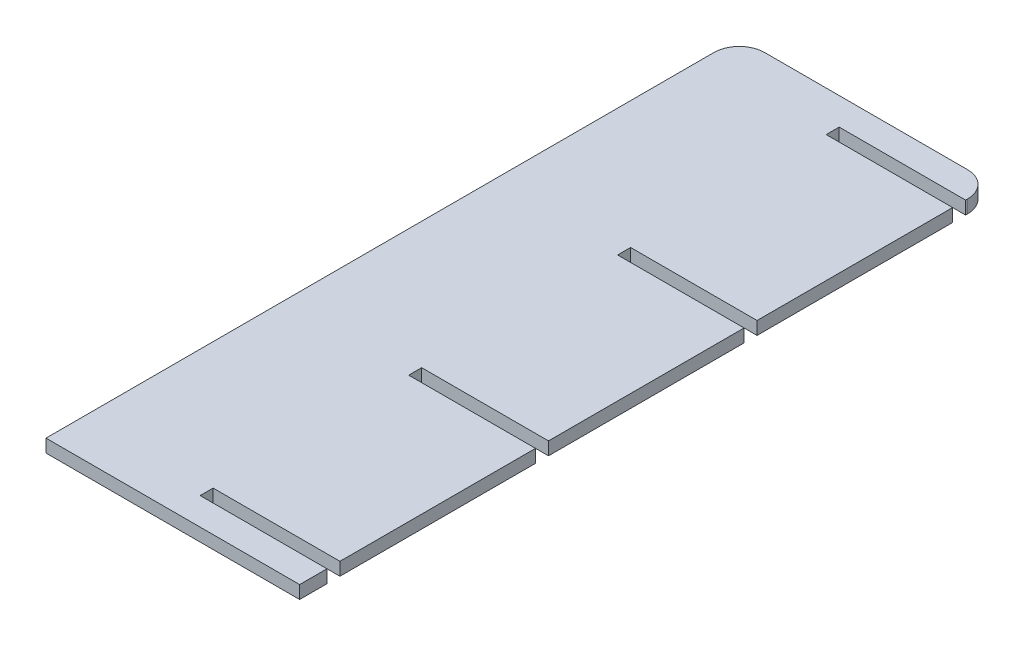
SolidWorks part; units mm, degrees
ref_plane "Alzado" through (0, 0, 0) normal (0, 0, 1) x (1, 0, 0)
ref_plane "Planta" through (0, 0, 0) normal (0, 1, 0) x (1, 0, 0)
ref_plane "Vista lateral" through (0, 0, 0) normal (1, 0, 0) x (0, 0, -1)
sketch "Croquis1" plane through (0, 0, 0) normal (0, 1, 0) x (1, 0, 0)
  line L0 (-56.986, -430.7706) -> (393.014, -430.7706)
  line L1 (393.014, 750.7294) -> (393.014, 754.2294)
  line L2 (348.014, 799.2294) -> (-11.986, 799.2294)
  line L3 (-56.986, 754.2294) -> (-56.986, -430.7706)
  line L4 (393.014, -430.7706) -> (393.014, -382.2706)
  line L6 (168.014, -382.2706) -> (168.014, -359.2706)
  line L8 (393.014, -359.2706) -> (393.014, -12.2706)
  line L10 (168.014, -12.2706) -> (168.014, 10.7294)
  line L12 (393.014, 10.7294) -> (393.014, 357.7294)
  line L14 (168.7164, 357.7294) -> (168.7164, 380.7294)
  line L16 (393.014, 380.7294) -> (393.014, 727.7294)
  line L18 (168.7164, 727.7294) -> (168.7164, 750.7294)
  line L28 (168.7164, 750.7294) -> (393.014, 750.7294)
  line L29 (393.014, 727.7294) -> (168.7164, 727.7294)
  line L30 (168.7164, 380.7294) -> (393.014, 380.7294)
  line L31 (393.014, 357.7294) -> (168.7164, 357.7294)
  line L32 (168.014, 10.7294) -> (393.014, 10.7294)
  line L33 (393.014, -12.2706) -> (168.014, -12.2706)
  line L34 (168.014, -359.2706) -> (393.014, -359.2706)
  line L35 (393.014, -382.2706) -> (168.014, -382.2706)
  arc A0 (393.014, 754.2294) -> (348.014, 799.2294) centre (348.014, 754.2294) ccw
  arc A1 (-11.986, 799.2294) -> (-56.986, 754.2294) centre (-11.986, 754.2294) ccw
  point P22 (393.014, 799.2294)
  dimension "D15" = 45
  dimension "D1" = 450
extrude "Saliente-Extruir1" add sketch "Croquis1" along normal blind 23
